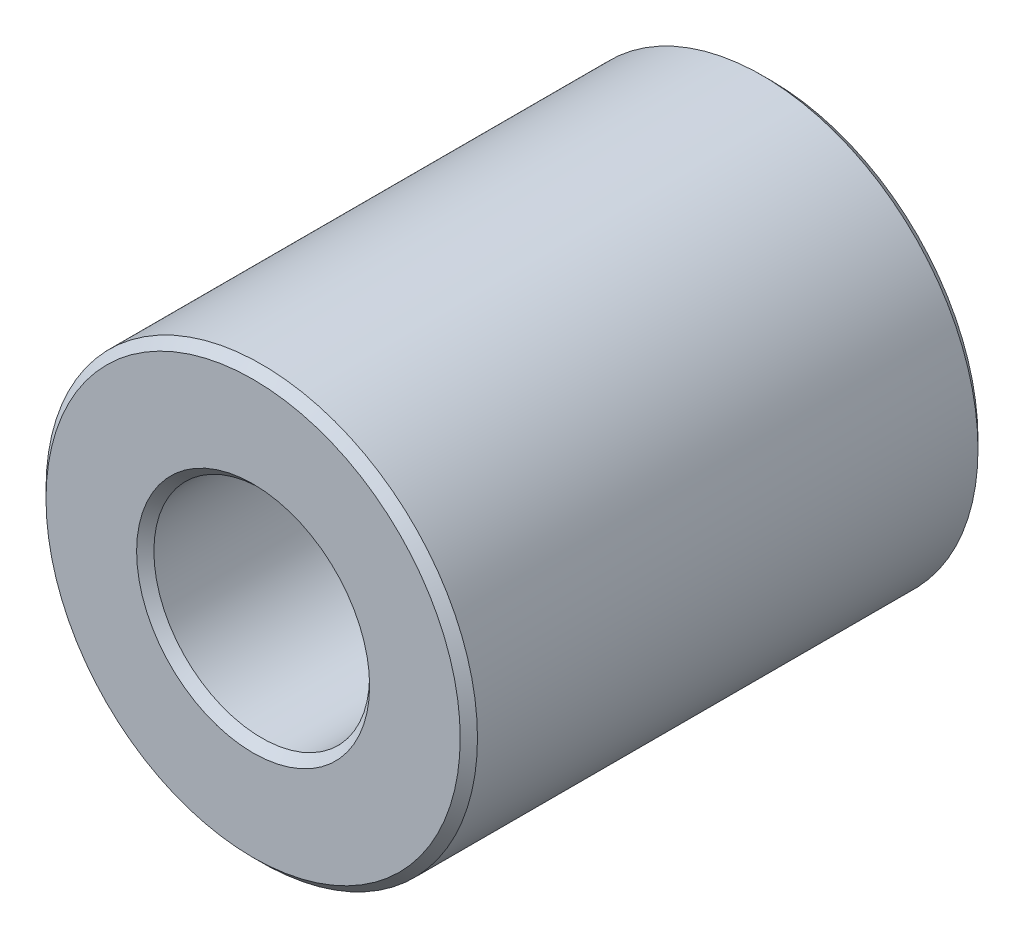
SolidWorks part; units mm, degrees
ref_plane "Front Plane" through (0, 0, 0) normal (0, 0, 1) x (1, 0, 0)
ref_plane "Top Plane" through (0, 0, 0) normal (0, 1, 0) x (1, 0, 0)
ref_plane "Right Plane" through (0, 0, 0) normal (1, 0, 0) x (0, 0, -1)
sketch "Sketch1" plane through (0, 0, 0) normal (0, 0, 1) x (1, 0, 0)
  circle A0 centre (0, 0) radius 2.5
  circle A1 centre (0, 0) radius 1.25
  dimension "D1" = 5
  dimension "D2" = 2.5
extrude "Boss-Extrude2" add sketch "Sketch1" along normal mid plane 6
chamfer "Chamfer3" distance 0.1 angle 45 4 edges at (2.5, 0, 3) (2.5, 0, -3) (1.25, 0, -3) (1.25, 0, 3)
